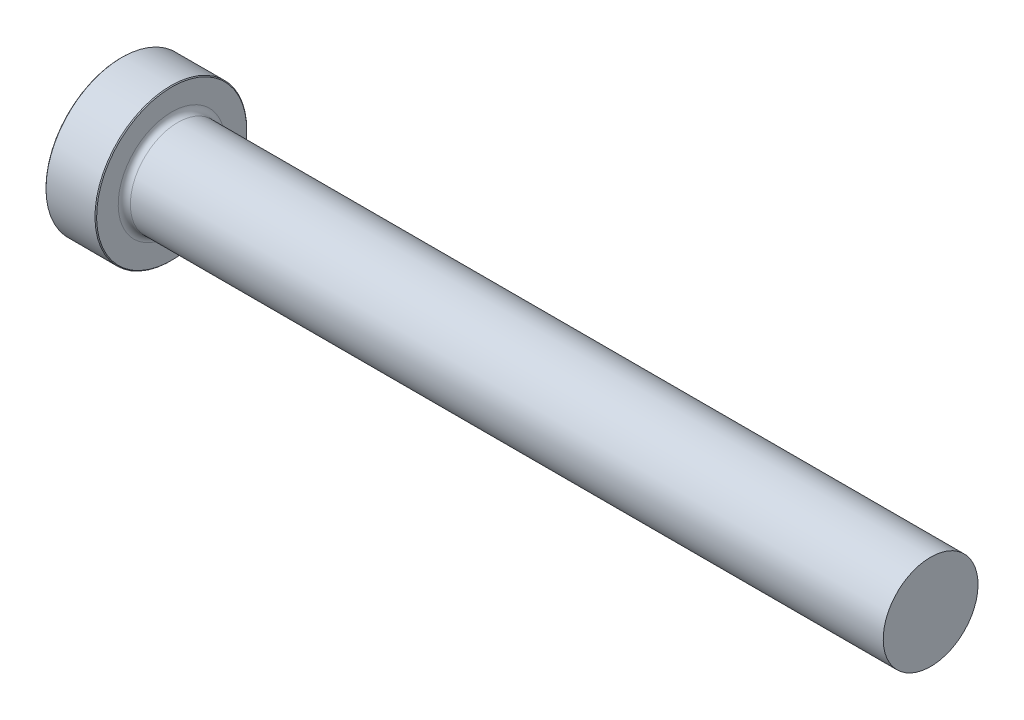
SolidWorks part; units mm, degrees
ref_plane "Front Plane" through (0, 0, 0) normal (0, 0, 1) x (1, 0, 0)
ref_plane "Top Plane" through (0, 0, 0) normal (0, 1, 0) x (1, 0, 0)
ref_plane "Right Plane" through (0, 0, 0) normal (1, 0, 0) x (0, 0, -1)
sketch "Sketch1" plane through (0, 0, 0) normal (0, 0, 1) x (1, 0, 0)
  line L0 (0, 0) -> (0, 9.525)
  line L1 (0, 9.525) -> (6.35, 9.525)
  line L2 (6.35, 9.525) -> (6.35, 6.7113)
  line L3 (7.112, 5.9493) -> (101.6, 5.9493)
  line L4 (101.6, 5.9493) -> (101.6, 0)
  line L5 (101.6, 0) -> (0, 0)
  line L6 (101.6, 0) -> (101.6, -5.9493) construction
  line L7 (101.6, -5.9493) -> (6.35, -5.9493) construction
  line L8 (0, 0) -> (0, -9.525) construction
  line L9 (0, -9.525) -> (6.35, -9.525) construction
  line L10 (6.35, -9.525) -> (6.35, -5.9493) construction
  arc A0 (6.35, 6.7113) -> (7.112, 5.9493) centre (7.112, 6.7113) ccw
  dimension "D4" = 0.762
  dimension "L" = 101.6
  dimension "D" = 11.8986
  dimension "H" = 19.05
  dimension "T" = 6.35
revolve "Revolve1" add sketch "Sketch1" angle 360 about L5
chamfer "Chamfer1" distance 0.1016 angle 45 2 edges at (0, 9.525, 0) (6.35, 9.525, 0)
